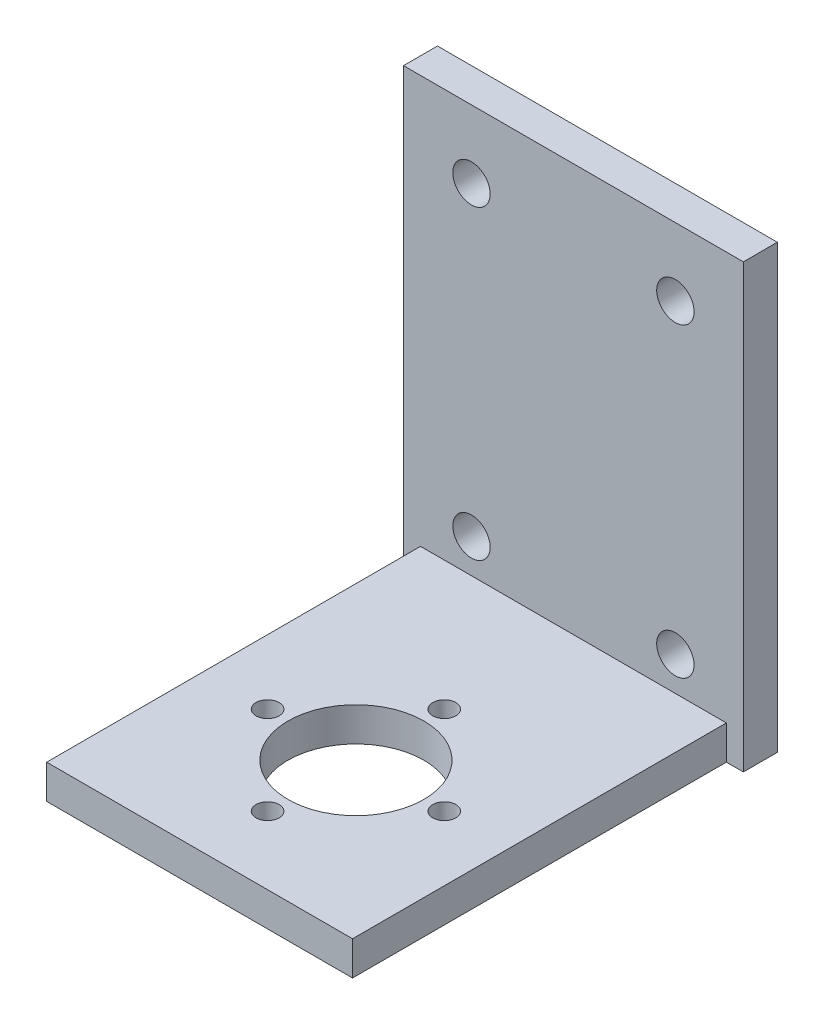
SolidWorks part; units mm, degrees
ref_plane "Front Plane" through (0, 0, 0) normal (1, 0, 0) x (0, 1, 0)
ref_plane "Top Plane" through (0, 0, 0) normal (0, 0, 1) x (0, 1, 0)
ref_plane "Right Plane" through (0, 0, 0) normal (0, 1, 0) x (-1, 0, 0)
sketch "Sketch1" plane through (0, 0, 0) normal (0, 0, 1) x (0, 1, 0)
  line L1 (-32.5, -25) -> (32.5, -25)
  line L2 (-32.5, -25) -> (-32.5, 25)
  line L3 (-32.5, 25) -> (32.5, 25)
  line L4 (32.5, -25) -> (32.5, 25)
  line L5 (-32.5, -25) -> (32.5, 25) construction
  line L6 (-32.5, 25) -> (32.5, -25) construction
  point P0 (0, 0)
  dimension "D1" = 65
  dimension "D2" = 50
extrude "Boss-Extrude1" add sketch "Sketch1" along normal blind 5
sketch "Sketch2" plane through (0, 0, 5) normal (0, 0, 1) x (1, 0, 0)
  line L0 (0, -32.5) -> (-22.5, -32.5)
  line L1 (0, -32.5) -> (0, 32.217) construction
  line L2 (-25, -32.5) -> (25, -32.5) construction
  line L3 (-22.5, -32.5) -> (-22.5, -27.5)
  line L4 (-22.5, -27.5) -> (22.5, -27.5)
  line L5 (22.5, -27.5) -> (22.5, -32.5)
  line L6 (22.5, -32.5) -> (0, -32.5)
  dimension "D1" = 22.5
  dimension "D2" = 22.5
  dimension "D3" = 5
extrude "Boss-Extrude2" add sketch "Sketch2" along normal blind 55
sketch "Sketch3" plane through (0, -32.5, 0) normal (0, -1, 0) x (1, 0, 0)
  line L0 (22.5, 5) -> (25, 5) construction
  circle A0 centre (0, 37) radius 10
  dimension "D1" = 20
  dimension "D2" = 32
extrude "Cut-Extrude1" cut sketch "Sketch3" against normal through all
sketch "Sketch4" plane through (0, -32.5, 0) normal (0, -1, 0) x (1, 0, 0)
  circle A0 centre (0, 37) radius 13 construction
  dimension "D1" = 26
sketch "Sketch5" plane through (0, -32.5, 0) normal (0, -1, 0) x (1, 0, 0)
  circle A0 centre (0, 50) radius 1.7
  circle A1 centre (0, 37) radius 13 construction
  circle A2 centre (13, 37) radius 1.7
  circle A3 centre (0, 24) radius 1.7
  circle A4 centre (-13, 37) radius 1.7
  dimension "D1" = 3.4
  dimension "D2" = 3.4
  dimension "D3" = 3.4
  dimension "D4" = 3.4
extrude "Cut-Extrude2" cut sketch "Sketch5" against normal through all
sketch "Sketch6" plane through (0, 0, 5) normal (0, 0, 1) x (1, 0, 0)
  line L0 (25, 32.5) -> (-25, 32.5) construction
  line L1 (-25, 32.5) -> (-25, -32.5) construction
  line L2 (25, -32.5) -> (25, 32.5) construction
  line L3 (22.5, -27.5) -> (-22.5, -27.5) construction
  circle A0 centre (-15, 22.5) radius 2.75
  circle A1 centre (15, 22.5) radius 2.75
  circle A2 centre (-15, -22.5) radius 2.75
  circle A3 centre (15, -22.5) radius 2.75
  dimension "D1" = 5.5
  dimension "D2" = 5.5
  dimension "D3" = 5.5
  dimension "D4" = 5.5
  dimension "D5" = 10
  dimension "D6" = 10
  dimension "D7" = 10
  dimension "D8" = 10
  dimension "D9" = 10
  dimension "D10" = 5
  dimension "D11" = 5
  dimension "D12" = 10
extrude "Cut-Extrude3" cut sketch "Sketch6" against normal through all
